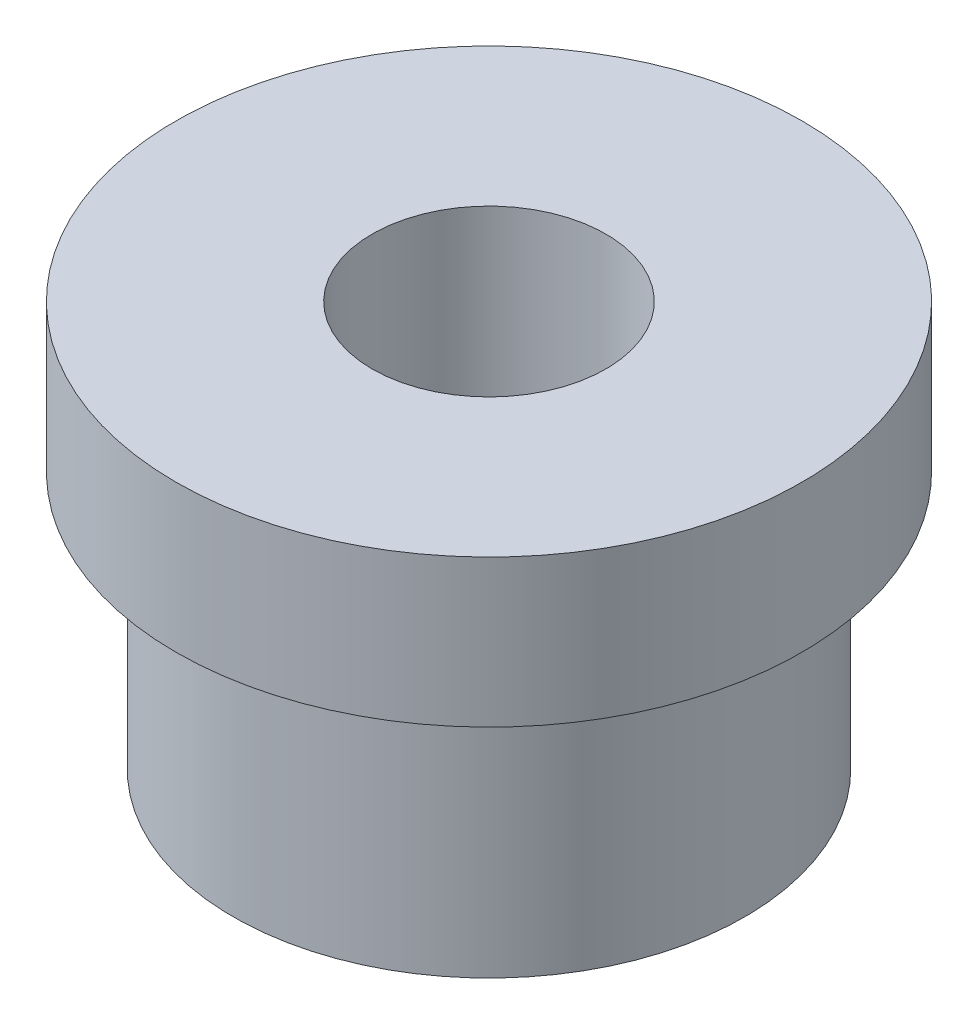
SolidWorks part; units mm, degrees
ref_plane "Front" through (0, 0, 0) normal (0, 0, 1) x (1, 0, 0)
ref_plane "Top" through (0, 0, 0) normal (0, 1, 0) x (1, 0, 0)
ref_plane "Right" through (0, 0, 0) normal (1, 0, 0) x (0, 0, -1)
ref_axis "Axis1" through (0, -50, 0) along (0, 1, 0)
sketch "Sketch1" plane through (0, 0, 0) normal (1, 0, 0) x (0, 0, -1)
  line L0 (-4.25, 2.75) -> (0, 2.75)
  line L1 (0, 2.75) -> (0, -2.75)
  line L2 (0, -2.75) -> (-3.4735, -2.75)
  line L3 (-3.4735, -2.75) -> (-3.4735, 0.75)
  line L4 (-3.4735, 0.75) -> (-4.25, 0.75)
  line L5 (-4.25, 0.75) -> (-4.25, 2.75)
  point P4 (0, 0)
  dimension "D1" = 2
  dimension "D2" = 3.4735
  dimension "D3" = 4.25
  dimension "D5" = 3.5
sketch "Sketch3" plane through (0, 0, 0) normal (1, 0, 0) x (0, 0, -1)
  line L6 (0, 2.75) -> (-4.25, 2.75)
  line L7 (0, -2.75) -> (0, 2.75)
  line L8 (-3.4735, -2.75) -> (0, -2.75)
  line L9 (-3.4735, 0.75) -> (-3.4735, -2.75)
  line L10 (-4.25, 0.75) -> (-3.4735, 0.75)
  line L11 (-4.25, 2.75) -> (-4.25, 0.75)
  line L12 (0, 2.75) -> (-4.25, 2.75)
  line L13 (0, -2.75) -> (0, 2.75)
  line L14 (-3.4735, -2.75) -> (0, -2.75)
  line L15 (-3.4735, 0.75) -> (-3.4735, -2.75)
  line L16 (-4.25, 0.75) -> (-3.4735, 0.75)
  line L17 (-4.25, 2.75) -> (-4.25, 0.75)
  dimension "D1" = 0
revolve "Revolve1" add sketch "Sketch3" angle 360 about axis through (0, -50, 0) along (0, 1, 0)
hole_wizard "1/8 (0.125) Diameter Hole1" positions "Sketch4" profile "Sketch5" hole size "1/8" standard "ANSI Inch"
sketch "Sketch4" plane through (0, 2.75, 0) normal (0, 1, 0) x (1, 0, 0)
  point P0 (0, 0)
sketch "Sketch5" plane through (0, 2.75, 0) normal (1, 0, 0) x (0, 0, 1)
  line L0 (0, 0) -> (0, 5.5)
  line L1 (0, 5.5) -> (1.5875, 5.5)
  line L2 (1.5875, 5.5) -> (1.5875, 0)
  line L5 (1.5875, 0) -> (0, 0)
  line L11 (0, -6.35) -> (0, 107.95) construction
  dimension "Thru Hole Dia." = 3.175
  dimension "Thru Hole Depth" = 5.5
